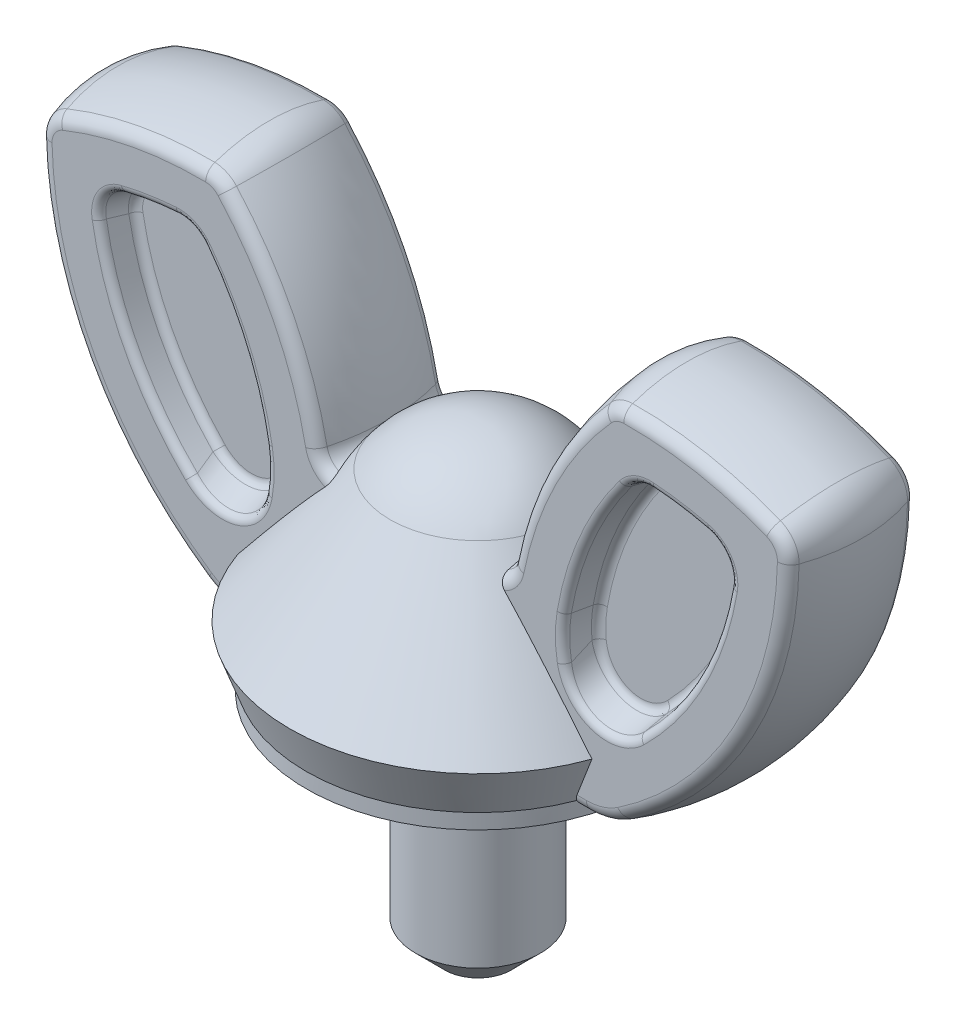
SolidWorks part; units mm, degrees
ref_plane "Front Plane" through (0, 0, 0) normal (0, 0, 1) x (1, 0, 0)
ref_plane "Top Plane" through (0, 0, 0) normal (0, 1, 0) x (1, 0, 0)
ref_plane "Right Plane" through (0, 0, 0) normal (1, 0, 0) x (0, 0, -1)
sketch "Sketch1" plane through (0, 0, 0) normal (0, 0, 1) x (1, 0, 0)
  line L0 (0, 10.7344) -> (0, 0) construction
  line L5 (4.826, 0) -> (-4.826, 0)
  line L6 (2.413, 5.08) -> (-2.413, 5.08)
  arc A11 (-2.413, 5.08) -> (-5.3975, 10.9034) centre (-13.1787, 3.2391) ccw
  arc A13 (-5.3975, 10.9034) -> (-10.795, 9.8298) centre (-6.0342, 0) ccw
  arc A24 (-10.795, 9.8298) -> (-6.0486, 0.3742) centre (0, 9.3295) ccw
  arc A26 (-4.826, 0) -> (-6.0486, 0.3742) centre (-4.826, 2.1844) cw
  arc A29 (4.826, 0) -> (6.0486, 0.3742) centre (4.826, 2.1844) ccw
  arc A34 (10.795, 9.8298) -> (6.0486, 0.3742) centre (0, 9.3295) cw
  arc A36 (5.3975, 10.9034) -> (10.795, 9.8298) centre (6.0342, 0) cw
  arc A37 (2.413, 5.08) -> (5.3975, 10.9034) centre (13.1787, 3.2391) cw
  point P19 (0, 0)
  point P27 (0, 5.08)
  point P29 (0, 5.08)
  point P44 (0, 5.08)
  dimension "D2" = 2.1844
  dimension "D1" = 5.3975
  dimension "D3" = 9.8298
  dimension "D4" = 10.922
  dimension "B" = 10.922
  dimension "A" = 21.59
  dimension "E" = 9.652
  dimension "G" = 5.08
  dimension "D5" = 4.826
extrude "Extrude1" add sketch "Sketch1" along normal mid plane 3.556
fillet "Fillet4" radius 1.0922 4 edges at (10.795, 9.8298, 0) (5.3975, 10.9034, 0) (-5.3975, 10.9034, 0) (-10.795, 9.8298, 0)
sketch "Sketch2" plane through (0, 0, 1.778) normal (0, 0, 1) x (1, 0, 0)
  line L0 (0, 0) -> (0, 12.8329) construction
  line L1 (-4.826, 0) -> (4.826, 0) construction
  arc A10 (-4.1864, 4.7767) -> (-5.0416, 1.8652) centre (-7.5893, 4.1949) cw
  arc A11 (4.1864, 4.7767) -> (6.2055, 9.1212) centre (13.1787, 3.2391) cw
  arc A12 (6.2055, 9.1212) -> (8.9805, 8.634) centre (6.0342, 0) cw
  arc A13 (8.9805, 8.634) -> (5.0416, 1.8652) centre (0, 9.3295) cw
  arc A14 (4.1864, 4.7767) -> (5.0416, 1.8652) centre (7.5893, 4.1949) ccw
  arc A15 (-8.9805, 8.634) -> (-5.0416, 1.8652) centre (0, 9.3295) ccw
  arc A16 (-6.2055, 9.1212) -> (-8.9805, 8.634) centre (-6.0342, 0) ccw
  arc A17 (-4.1864, 4.7767) -> (-6.2055, 9.1212) centre (-13.1787, 3.2391) ccw
  arc A18 (-8.9805, 8.634) -> (-5.0416, 1.8652) centre (0, 9.3295) ccw
  arc A19 (-6.2055, 9.1212) -> (-8.9805, 8.634) centre (-6.0342, 0) ccw
  arc A20 (-4.1864, 4.7767) -> (-6.2055, 9.1212) centre (-13.1787, 3.2391) ccw
  dimension "D1" = 1.7992
extrude "Cut-Extrude1" cut sketch "Sketch2" against normal blind 0.889 draft 10
fillet "Fillet1" radius 0.889 4 edges
fillet "Fillet6" radius 1.2446 2 edges
fillet "Fillet5" radius 0.3641 2 edges at (2.413, 5.08, 0) (-2.413, 5.08, 0)
fillet "Fillet3" radius 0.2223 28 edges at (7.4585, 9.011, 1.778) (7.4007, 8.8613, 0.889) (6.4621, 8.9114, 0.889) (8.6146, 8.3041, 0.889) (7.8855, 5.3103, 0.889) (4.2988, 4.3764, 0.889) (6.1282, 8.9579, 1.778) (8.7221, 8.5339, 1.778) (7.9776, 5.1471, 1.778) (4.1377, 4.1292, 1.778) (-4.2988, 4.3764, 0.889) (-7.8855, 5.3103, 0.889) (-8.5332, 8.4279, 0.889) (-7.4007, 8.8613, 0.889) (-6.1942, 8.7899, 0.889) (-4.1377, 4.1292, 1.778) (-7.9776, 5.1471, 1.778) (-8.7866, 8.4358, 1.778) (-7.4585, 9.011, 1.778) (-6.3795, 9.0717, 1.778) (4.9351, 6.7652, 0.889) (4.81, 6.8709, 1.778) (-4.9351, 6.7652, 0.889) (-4.81, 6.8709, 1.778) (4.9742, 2.938, 0.889) (5.0791, 2.5366, 1.778) (-5.2102, 2.8514, 0.889) (-5.0131, 2.5568, 1.778)
mirror "Mirror1" about plane through (0, 0, 0) normal (0, 0, 1) of "Fillet6", "Fillet3", "Fillet1", "Cut-Extrude1"
sketch "Sketch4" plane through (0, 0, 0) normal (1, 0, 0) x (0, 0, -1)
  line L1 (-1.778, 5.334) -> (1.778, 5.334)
  line L2 (-1.778, 4.4704) -> (-1.778, 5.334)
  line L4 (1.778, 0.3742) -> (1.778, 9.0918) construction
  line L6 (-1.778, 9.0918) -> (-1.778, 0.3742) construction
  line L7 (0, 5.715) -> (0, 0.381) construction
  line L9 (1.778, 4.4704) -> (1.778, 5.334)
  line L10 (-1.778, 5.08) -> (1.778, 5.08) construction
  arc A0 (-1.524, 4.826) -> (-1.778, 4.4704) centre (-1.4021, 4.4704) ccw
  arc A1 (1.524, 4.826) -> (-1.524, 4.826) centre (0, 0.381) ccw
  arc A2 (1.524, 4.826) -> (1.778, 4.4704) centre (1.4021, 4.4704) cw
  point P8 (0, 5.08)
  dimension "D1" = 0.254
  dimension "D2" = 0.254
  dimension "D3" = 0.254
sketch3d "3DSketch1"
  line L2 (-2.1102, 5.08, 1.778) -> (2.1102, 5.08, 1.778)
  line L3 (4.826, 0, 1.778) -> (-4.826, 0, 1.778)
  line L4 (-2.1102, 5.08, 1.778) -> (2.1102, 5.08, 1.778)
  line L5 (4.826, 0, 1.778) -> (-4.826, 0, 1.778)
  arc A15 (10.804, 9.0918, 1.778) -> (6.0486, 0.3742, 1.778) centre (0, 9.3295, 1.778) ccw
  arc A16 (10.1207, 10.1287, 1.778) -> (10.804, 9.0918, 1.778) centre (9.712, 9.1158, 1.778) ccw
  arc A17 (5.8682, 10.9207, 1.778) -> (10.1207, 10.1287, 1.778) centre (6.0342, 0, 1.778) ccw
  arc A18 (5.0743, 10.5608, 1.778) -> (5.8682, 10.9207, 1.778) centre (5.8848, 9.8287, 1.778) ccw
  arc A19 (2.4672, 5.3729, 1.778) -> (5.0743, 10.5608, 1.778) centre (13.1787, 3.2391, 1.778) ccw
  arc A20 (2.1102, 5.08, 1.778) -> (2.4672, 5.3729, 1.778) centre (2.1102, 5.4441, 1.778) ccw
  arc A21 (2.1102, 5.08, 1.778) -> (2.4672, 5.3729, 1.778) centre (2.1102, 5.4441, 1.778) ccw
  arc A22 (-5.0743, 10.5608, 1.778) -> (-2.4672, 5.3729, 1.778) centre (-13.1787, 3.2391, 1.778) ccw
  arc A23 (-5.8682, 10.9207, 1.778) -> (-5.0743, 10.5608, 1.778) centre (-5.8848, 9.8287, 1.778) ccw
  arc A24 (-10.1207, 10.1287, 1.778) -> (-5.8682, 10.9207, 1.778) centre (-6.0342, 0, 1.778) ccw
  arc A25 (-10.804, 9.0918, 1.778) -> (-10.1207, 10.1287, 1.778) centre (-9.712, 9.1158, 1.778) ccw
  arc A26 (-6.0486, 0.3742, 1.778) -> (-10.804, 9.0918, 1.778) centre (0, 9.3295, 1.778) ccw
  arc A27 (-4.826, 0, 1.778) -> (-6.0486, 0.3742, 1.778) centre (-4.826, 2.1844, 1.778) ccw
  arc A28 (6.0486, 0.3742, 1.778) -> (4.826, 0, 1.778) centre (4.826, 2.1844, 1.778) ccw
  arc A29 (10.804, 9.0918, 1.778) -> (6.0486, 0.3742, 1.778) centre (0, 9.3295, 1.778) ccw
  arc A30 (10.1207, 10.1287, 1.778) -> (10.804, 9.0918, 1.778) centre (9.712, 9.1158, 1.778) ccw
  arc A31 (5.8682, 10.9207, 1.778) -> (10.1207, 10.1287, 1.778) centre (6.0342, 0, 1.778) ccw
  arc A32 (5.0743, 10.5608, 1.778) -> (5.8682, 10.9207, 1.778) centre (5.8848, 9.8287, 1.778) ccw
  arc A33 (2.4672, 5.3729, 1.778) -> (5.0743, 10.5608, 1.778) centre (13.1787, 3.2391, 1.778) ccw
  arc A34 (-2.4672, 5.3729, 1.778) -> (-2.1102, 5.08, 1.778) centre (-2.1102, 5.4441, 1.778) ccw
  arc A35 (-2.4672, 5.3729, 1.778) -> (-2.1102, 5.08, 1.778) centre (-2.1102, 5.4441, 1.778) ccw
  arc A36 (-5.0743, 10.5608, 1.778) -> (-2.4672, 5.3729, 1.778) centre (-13.1787, 3.2391, 1.778) ccw
  arc A37 (-5.8682, 10.9207, 1.778) -> (-5.0743, 10.5608, 1.778) centre (-5.8848, 9.8287, 1.778) ccw
  arc A38 (-10.1207, 10.1287, 1.778) -> (-5.8682, 10.9207, 1.778) centre (-6.0342, 0, 1.778) ccw
  arc A39 (-10.804, 9.0918, 1.778) -> (-10.1207, 10.1287, 1.778) centre (-9.712, 9.1158, 1.778) ccw
  arc A40 (-6.0486, 0.3742, 1.778) -> (-10.804, 9.0918, 1.778) centre (0, 9.3295, 1.778) ccw
  arc A41 (-4.826, 0, 1.778) -> (-6.0486, 0.3742, 1.778) centre (-4.826, 2.1844, 1.778) ccw
  arc A42 (6.0486, 0.3742, 1.778) -> (4.826, 0, 1.778) centre (4.826, 2.1844, 1.778) ccw
  point P3 (2.1102, 5.4441, 2.1421)
  point P5 (2.1102, 5.4441, 2.1421)
  point P11 (-2.1102, 5.4441, 2.1421)
  point P13 (-2.1102, 5.4441, 2.1421)
  point P43 (0, 9.3295, -9.0286)
  point P46 (9.712, 9.1158, 0.6858)
  point P48 (6.0342, 0, -9.144)
  point P50 (5.8848, 9.8287, 0.6858)
  point P52 (13.1787, 3.2391, -9.144)
  point P58 (-13.1787, 3.2391, -9.144)
  point P60 (-5.8848, 9.8287, 0.6858)
  point P62 (-6.0342, 0, -9.144)
  point P64 (-9.712, 9.1158, 0.6858)
  point P66 (0, 9.3295, -9.0286)
  point P68 (-4.826, 2.1844, -0.4064)
  point P70 (4.826, 2.1844, -0.4064)
  point P71 (0, 9.3295, -9.0286)
  point P72 (9.712, 9.1158, 0.6858)
  point P73 (6.0342, 0, -9.144)
  point P74 (5.8848, 9.8287, 0.6858)
  point P75 (13.1787, 3.2391, -9.144)
  point P78 (-13.1787, 3.2391, -9.144)
  point P79 (-5.8848, 9.8287, 0.6858)
  point P80 (-6.0342, 0, -9.144)
  point P81 (-9.712, 9.1158, 0.6858)
  point P82 (0, 9.3295, -9.0286)
  point P83 (-4.826, 2.1844, -0.4064)
  point P84 (4.826, 2.1844, -0.4064)
  dimension "D1" = 0
sweep "Cut-Sweep2" cut profiles "Sketch4" path "3DSketch1"
sketch "Sketch3" plane through (0, 0, 0) normal (0, 0, 1) x (1, 0, 0)
  line L0 (0, 6.5903) -> (0, -11.3525) construction
  line L1 (1.7526, 0) -> (4.826, 0)
  line L2 (5.2882, 1.6933) -> (2.4672, 5.3729)
  line L4 (1.7526, 0) -> (1.7526, -6.35)
  line L5 (1.7526, -6.35) -> (0, -6.35)
  line L6 (4.826, 0) -> (4.826, 0.4233)
  line L7 (0, 6.5903) -> (0, -6.35)
  line L8 (0, 6.5903) -> (-2.4754, 6.5903) construction
  line L9 (4.826, 0.4233) -> (5.2882, 1.6933)
  arc A1 (2.4672, 5.3729) -> (0, 6.5903) centre (0, 3.4814) ccw
  dimension "D2" = 1.27
  dimension "D3" = 9.652
  dimension "d1" = 3.5052
  dimension "D4" = 0.4233
  dimension "L" = 6.35
  dimension "D5" = 20
revolve "Revolve1" add sketch "Sketch3" angle 360 about L0
sketch "Sketch6" plane through (0, 0, 0) normal (0, 0, 1) x (1, 0, 0)
  line L0 (0, 4.5862) -> (0, -4.5862) construction
  line L3 (0.9398, -6.604) -> (1.778, -6.604)
  line L4 (1.778, -6.604) -> (1.778, -5.5118)
  line L5 (1.778, -5.5118) -> (0.9398, -6.35)
  line L6 (-1.7526, -6.35) -> (1.7526, -6.35) construction
  line L7 (1.7526, -6.35) -> (1.7526, 0) construction
  line L8 (0.9398, -6.35) -> (0.9398, -6.604)
  dimension "D1" = 45
  dimension "D3" = 0.254
  dimension "O" = 1.8796
  dimension "D5" = 0.0254
revolve "Cut-Revolve11" cut sketch "Sketch6" angle 360 about L0
sketch "Sketch5" plane through (0, 0, 0) normal (0, 0, 1) x (1, 0, 0)
  line L0 (1.7526, -0.0254) -> (1.2802, -0.2982)
  line L1 (1.2802, -0.2982) -> (1.7526, -0.5709)
  line L2 (1.7526, -0.5709) -> (1.7526, -0.0254)
  line L3 (0, 0) -> (0, -7.7715) construction
  line L6 (1.2802, -0.2982) -> (1.2802, -1.0906) construction
  dimension "D1" = 3.5052
  dimension "D2" = 2.5603
  dimension "D3" = 0.0254
  dimension "pitch" = 0.7925
revolve "Cut-Revolve10" [suppressed] cut sketch "Sketch5" angle 360 about L3
pattern_linear "LPattern10" [suppressed] count 8 spacing 0.7925 along (0, -1, 0)
equation "\"D5@Sketch1\" = \"E@Sketch1\" / 2"
equation "\"D1@Sketch1\" = \"A@Sketch1\" / 4"
equation "\"D3@Sketch1\" = \"B@Sketch1\" * 9 /  10"
equation "\"D4@Sketch1\" = \"B@Sketch1\""
equation "\"D2@Sketch1\" = \"D4@Sketch1\" / 5"
equation "\"D1@Cut-Extrude1\" = \"C@Extrude1\" / 4"
equation "\"D1@Fillet1\" = \"D1@Cut-Extrude1\""
equation "\"D1@Fillet3\" = \"D1@Cut-Extrude1\" / 4"
equation "\"D2@Sketch3\" = \"G@Sketch1\" / 4"
equation "\"D3@Sketch3\" = \"E@Sketch1\""
equation "\"D1@Sketch4\" = \"C@Extrude1\" / 14"
equation "\"D1@Sketch5\" = \"d1@Sketch3\""
equation "\"D2@Sketch5\" = \"THD_MINOR@Cosmetic Thread1\""
equation "\"D3@LPattern10\" = \"pitch@Sketch5\""
equation "\"D1@LPattern10\" = \"L@Sketch3\" / \"D3@LPattern10\""
equation "\"D1@Cosmetic Thread1\" = \"L@Sketch3\""
equation "\"D2@Sketch4\" = \"D1@Sketch4\""
equation "\"D4@Sketch3\" = \"D2@Sketch3\" / 3"
equation "\"D1@Fillet4\" = \"D2@Sketch1\" /2"
equation "\"D1@Sketch2\" = \"D1@Sketch1\" / 3"
equation "\"D1@Fillet5\" = \"D1@Fillet4\" / 3"
equation "\"D1@Fillet6\" = \"D1@Fillet1\" * 1.4"
